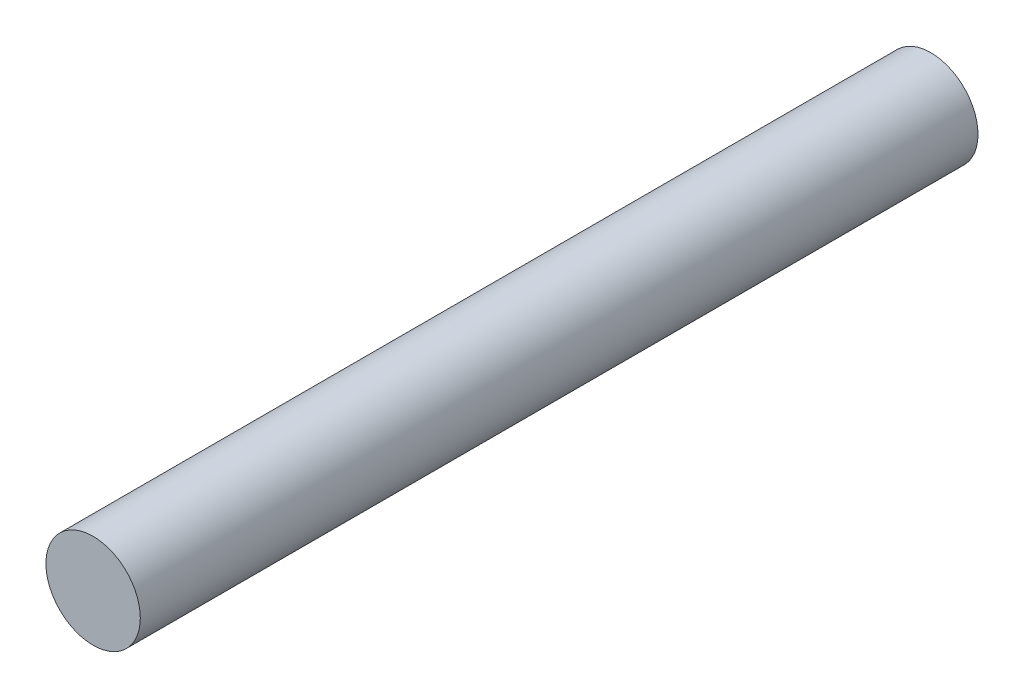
SolidWorks part; units mm, degrees
ref_plane "Front Plane" through (0, 0, 0) normal (0, 0, 1) x (1, 0, 0)
ref_plane "Top Plane" through (0, 0, 0) normal (0, 1, 0) x (1, 0, 0)
ref_plane "Right Plane" through (0, 0, 0) normal (1, 0, 0) x (0, 0, -1)
sketch "Sketch2" plane through (0, 0, 0) normal (0, 0, 1) x (1, 0, 0)
  circle A0 centre (-31.1914, 8.096) radius 4
  dimension "D1" = 8
extrude "Boss-Extrude1" add sketch "Sketch2" along normal blind 71
